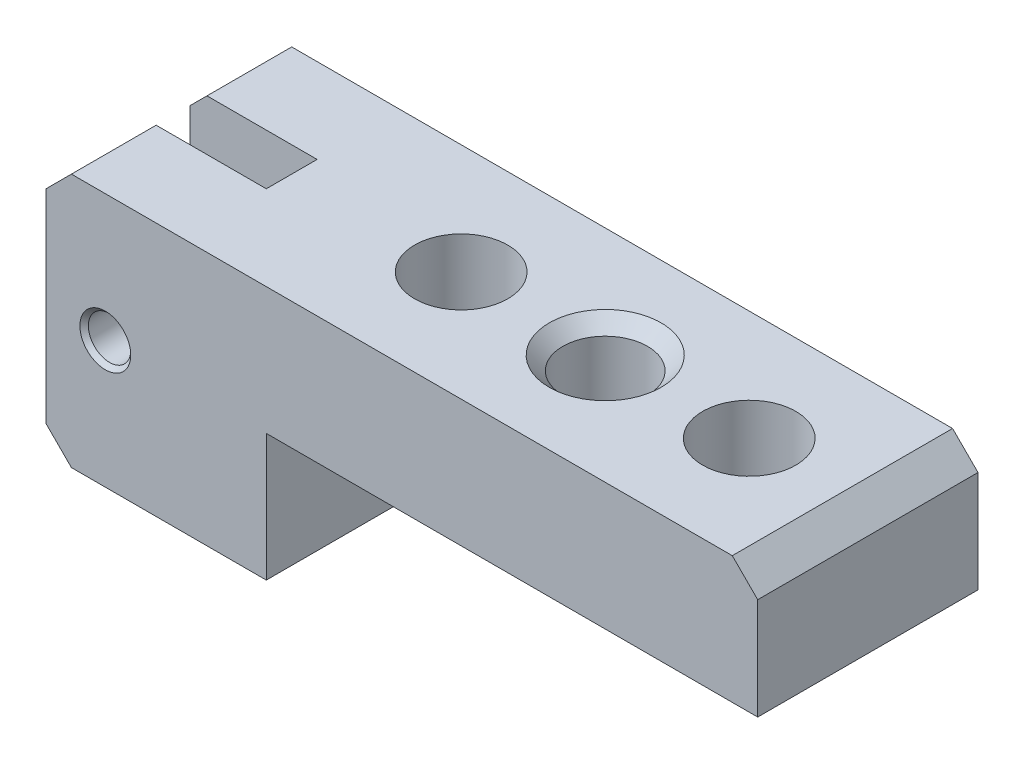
SolidWorks part; units mm, degrees
ref_plane "Спереди" through (0, 0, 0) normal (0, 0, 1) x (1, 0, 0)
ref_plane "Сверху" through (0, 0, 0) normal (0, 1, 0) x (1, 0, 0)
ref_plane "Справа" through (0, 0, 0) normal (1, 0, 0) x (0, 0, -1)
sketch "Эскиз1" plane through (0, 0, 0) normal (0, 0, 1) x (1, 0, 0)
  line L0 (0, 0) -> (-26, 0)
  line L1 (-26, 0) -> (-26, 30)
  line L2 (-26, 30) -> (58, 30)
  line L3 (58, 30) -> (58, 15)
  line L4 (58, 15) -> (0, 15)
  line L5 (0, 15) -> (0, 0)
  circle A0 centre (-19, 15) radius 2.5
  dimension "D5" = 5
  dimension "D1" = 30
  dimension "D2" = 84
  dimension "D3" = 26
  dimension "D4" = 15
  dimension "D6" = 7
  dimension "D7" = 15
extrude "Бобышка-Вытянуть1" add sketch "Эскиз1" against normal blind 26
sketch "Эскиз2" plane through (0, 30, 0) normal (0, 1, 0) x (1, 0, 0)
  line L0 (-26, 13) -> (63.2671, 13) construction
  line L1 (-26, 26) -> (-26, 0) construction
  line L2 (58, 26) -> (58, 0) construction
  line L3 (-26, 16) -> (-10, 16)
  line L4 (-26, 16) -> (-26, 10)
  line L5 (-26, 10) -> (-10, 10)
  line L6 (-10, 16) -> (-10, 10)
  circle A0 centre (10, 13) radius 5.5
  circle A1 centre (27, 13) radius 5
  circle A2 centre (44, 13) radius 5.5
  point P8 (-26, 13)
  dimension "D3" = 11
  dimension "D4" = 10
  dimension "D5" = 34
  dimension "D6" = 14
  dimension "D7" = 17
  dimension "D1" = 6
  dimension "D2" = 16
extrude "Вырез-Вытянуть1" cut sketch "Эскиз2" against normal through all
chamfer "Фаска1" distance 1.6 angle 45 1 edges at (27, 30, -8)
chamfer "Фаска2" distance 0.5 angle 45 2 edges at (-16.5, 15, -26) (-16.5, 15, 0)
chamfer "Фаска3" distance 3 angle 45 5 edges at (58, 30, -13) (-26, 0, -5) (-26, 0, -21) (-26, 30, -21) (-26, 30, -5)
chamfer "Фаска4" distance 1 angle 45 2 edges at (-26, 15, -10) (-26, 15, -16)
